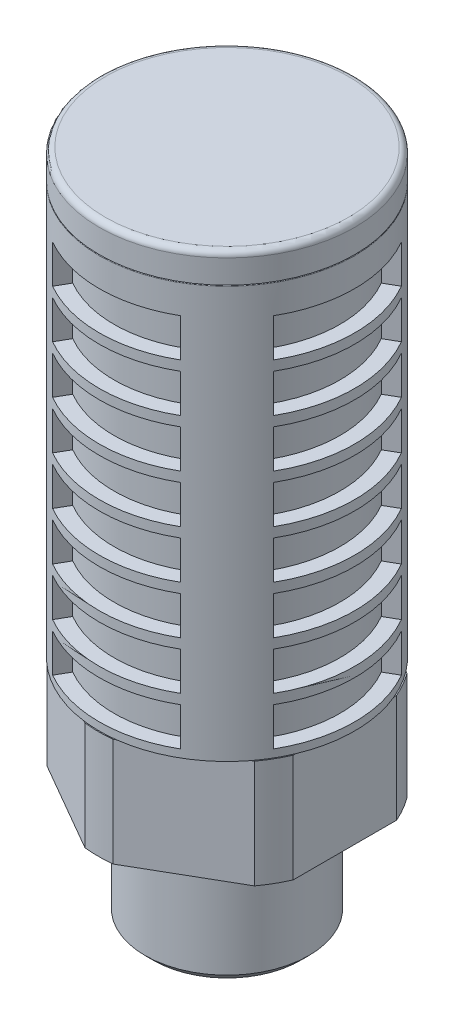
SolidWorks part; units mm, degrees
ref_plane "前视基准面" through (0, 0, 0) normal (0, 0, 1) x (1, 0, 0)
ref_plane "上视基准面" through (0, 0, 0) normal (0, 1, 0) x (1, 0, 0)
ref_plane "右视基准面" through (0, 0, 0) normal (1, 0, 0) x (0, 0, -1)
sketch "草图1" plane through (0, 0, 0) normal (0, 0, 1) x (1, 0, 0)
  line L0 (0, 68) -> (12.4, 68)
  line L1 (13, 67.4) -> (13, 65)
  line L2 (13, 65) -> (12.9, 65)
  line L3 (13, 64.9) -> (13, 23)
  line L4 (13, 23) -> (13.1064, 23)
  line L5 (13.1064, 23) -> (13.1064, 12)
  line L6 (13.1064, 12) -> (8.331, 12)
  line L7 (8.331, 12) -> (8.331, 0.856)
  line L8 (8.331, 0.856) -> (7.475, 0)
  line L9 (7.475, 0) -> (4.1655, 0)
  line L10 (4.1655, 0) -> (4.1655, 63)
  line L11 (4.1655, 63) -> (0, 65.405)
  line L12 (0, 65.405) -> (0, 68)
  line L13 (0, 0) -> (0, 68) construction
  arc A0 (12.4, 68) -> (13, 67.4) centre (12.4, 67.4) cw
  arc A1 (12.9, 65) -> (13, 64.9) centre (12.9, 64.9) cw
revolve "旋转1" add sketch "草图1" angle 360 about L13
sketch "草图2" plane through (0, 0, 0) normal (0, 0, 1) x (1, 0, 0)
  line L0 (11.5, 62) -> (11.5, 58.1)
  line L1 (11.5, 58.1) -> (13, 58.1)
  line L2 (13, 58.1) -> (13, 57.1)
  line L3 (13, 57.1) -> (11.5, 57.1)
  line L4 (11.5, 57.1) -> (11.5, 53.2)
  line L5 (11.5, 53.2) -> (13, 53.2)
  line L6 (13, 53.2) -> (13, 52.2)
  line L7 (13, 52.2) -> (11.5, 52.2)
  line L8 (11.5, 52.2) -> (11.5, 48.3)
  line L9 (11.5, 48.3) -> (13, 48.3)
  line L10 (13, 48.3) -> (13, 47.3)
  line L11 (13, 47.3) -> (11.5, 47.3)
  line L12 (11.5, 47.3) -> (11.5, 43.4)
  line L13 (11.5, 43.4) -> (13, 43.4)
  line L14 (13, 43.4) -> (13, 42.4)
  line L15 (13, 42.4) -> (11.5, 42.4)
  line L16 (11.5, 42.4) -> (11.5, 38.5)
  line L17 (11.5, 38.5) -> (13, 38.5)
  line L18 (13, 38.5) -> (13, 37.5)
  line L19 (13, 37.5) -> (11.5, 37.5)
  line L20 (11.5, 37.5) -> (11.5, 33.6)
  line L21 (11.5, 33.6) -> (13, 33.6)
  line L22 (13, 33.6) -> (13, 32.6)
  line L23 (13, 32.6) -> (11.5, 32.6)
  line L24 (11.5, 32.6) -> (11.5, 28.7)
  line L25 (11.5, 28.7) -> (13, 28.7)
  line L26 (13, 28.7) -> (13, 27.7)
  line L27 (13, 27.7) -> (11.5, 27.7)
  line L28 (11.5, 27.7) -> (11.5, 23.8)
  line L29 (11.5, 23.8) -> (26, 23.8)
  line L30 (26, 23.8) -> (26, 62)
  line L31 (26, 62) -> (11.5, 62)
  line L32 (0, 23.8) -> (0, 62) construction
revolve "切除-旋转1" cut sketch "草图2" angle 30 about L32
sketch "草图3" plane through (0, 0, 0) normal (0, 0, 1) x (1, 0, 0)
  line L0 (-26, 62) -> (-26, 23.8)
  line L1 (-26, 23.8) -> (-11.5, 23.8)
  line L2 (-11.5, 23.8) -> (-11.5, 27.7)
  line L3 (-11.5, 27.7) -> (-13, 27.7)
  line L4 (-13, 27.7) -> (-13, 28.7)
  line L5 (-13, 28.7) -> (-11.5, 28.7)
  line L6 (-11.5, 28.7) -> (-11.5, 32.6)
  line L7 (-11.5, 32.6) -> (-13, 32.6)
  line L8 (-13, 32.6) -> (-13, 33.6)
  line L9 (-13, 33.6) -> (-11.5, 33.6)
  line L10 (-11.5, 33.6) -> (-11.5, 37.5)
  line L11 (-11.5, 37.5) -> (-13, 37.5)
  line L12 (-13, 37.5) -> (-13, 38.5)
  line L13 (-13, 38.5) -> (-11.5, 38.5)
  line L14 (-11.5, 38.5) -> (-11.5, 42.4)
  line L15 (-11.5, 42.4) -> (-13, 42.4)
  line L16 (-13, 42.4) -> (-13, 43.4)
  line L17 (-13, 43.4) -> (-11.5, 43.4)
  line L18 (-11.5, 43.4) -> (-11.5, 47.3)
  line L19 (-11.5, 47.3) -> (-13, 47.3)
  line L20 (-13, 47.3) -> (-13, 48.3)
  line L21 (-13, 48.3) -> (-11.5, 48.3)
  line L22 (-11.5, 48.3) -> (-11.5, 52.2)
  line L23 (-11.5, 52.2) -> (-13, 52.2)
  line L24 (-13, 52.2) -> (-13, 53.2)
  line L25 (-13, 53.2) -> (-11.5, 53.2)
  line L26 (-11.5, 53.2) -> (-11.5, 57.1)
  line L27 (-11.5, 57.1) -> (-13, 57.1)
  line L28 (-13, 57.1) -> (-13, 58.1)
  line L29 (-13, 58.1) -> (-11.5, 58.1)
  line L30 (-11.5, 58.1) -> (-11.5, 62)
  line L31 (-11.5, 62) -> (-26, 62)
  line L32 (0, 62) -> (0, 23.8) construction
revolve "切除-旋转2" cut sketch "草图3" angle 30 about L32
sketch "草图4" plane through (0, 0, 0) normal (1, 0, 0) x (0, 0, -1)
  line L0 (11.5, 62) -> (11.5, 58.1)
  line L1 (11.5, 58.1) -> (13, 58.1)
  line L2 (13, 58.1) -> (13, 57.1)
  line L3 (13, 57.1) -> (11.5, 57.1)
  line L4 (11.5, 57.1) -> (11.5, 53.2)
  line L5 (11.5, 53.2) -> (13, 53.2)
  line L6 (13, 53.2) -> (13, 52.2)
  line L7 (13, 52.2) -> (11.5, 52.2)
  line L8 (11.5, 52.2) -> (11.5, 48.3)
  line L9 (11.5, 48.3) -> (13, 48.3)
  line L10 (13, 48.3) -> (13, 47.3)
  line L11 (13, 47.3) -> (11.5, 47.3)
  line L12 (11.5, 47.3) -> (11.5, 43.4)
  line L13 (11.5, 43.4) -> (13, 43.4)
  line L14 (13, 43.4) -> (13, 42.4)
  line L15 (13, 42.4) -> (11.5, 42.4)
  line L16 (11.5, 42.4) -> (11.5, 38.5)
  line L17 (11.5, 38.5) -> (13, 38.5)
  line L18 (13, 38.5) -> (13, 37.5)
  line L19 (13, 37.5) -> (11.5, 37.5)
  line L20 (11.5, 37.5) -> (11.5, 33.6)
  line L21 (11.5, 33.6) -> (13, 33.6)
  line L22 (13, 33.6) -> (13, 32.6)
  line L23 (13, 32.6) -> (11.5, 32.6)
  line L24 (11.5, 32.6) -> (11.5, 28.7)
  line L25 (11.5, 28.7) -> (13, 28.7)
  line L26 (13, 28.7) -> (13, 27.7)
  line L27 (13, 27.7) -> (11.5, 27.7)
  line L28 (11.5, 27.7) -> (11.5, 23.8)
  line L29 (11.5, 23.8) -> (26, 23.8)
  line L30 (26, 23.8) -> (26, 62)
  line L31 (26, 62) -> (11.5, 62)
  line L32 (0, 23.8) -> (0, 62) construction
revolve "切除-旋转3" cut sketch "草图4" angle 30 about L32
sketch "草图5" plane through (0, 0, 0) normal (1, 0, 0) x (0, 0, -1)
  line L0 (-26, 62) -> (-26, 23.8)
  line L1 (-26, 23.8) -> (-11.5, 23.8)
  line L2 (-11.5, 23.8) -> (-11.5, 27.7)
  line L3 (-11.5, 27.7) -> (-13, 27.7)
  line L4 (-13, 27.7) -> (-13, 28.7)
  line L5 (-13, 28.7) -> (-11.5, 28.7)
  line L6 (-11.5, 28.7) -> (-11.5, 32.6)
  line L7 (-11.5, 32.6) -> (-13, 32.6)
  line L8 (-13, 32.6) -> (-13, 33.6)
  line L9 (-13, 33.6) -> (-11.5, 33.6)
  line L10 (-11.5, 33.6) -> (-11.5, 37.5)
  line L11 (-11.5, 37.5) -> (-13, 37.5)
  line L12 (-13, 37.5) -> (-13, 38.5)
  line L13 (-13, 38.5) -> (-11.5, 38.5)
  line L14 (-11.5, 38.5) -> (-11.5, 42.4)
  line L15 (-11.5, 42.4) -> (-13, 42.4)
  line L16 (-13, 42.4) -> (-13, 43.4)
  line L17 (-13, 43.4) -> (-11.5, 43.4)
  line L18 (-11.5, 43.4) -> (-11.5, 47.3)
  line L19 (-11.5, 47.3) -> (-13, 47.3)
  line L20 (-13, 47.3) -> (-13, 48.3)
  line L21 (-13, 48.3) -> (-11.5, 48.3)
  line L22 (-11.5, 48.3) -> (-11.5, 52.2)
  line L23 (-11.5, 52.2) -> (-13, 52.2)
  line L24 (-13, 52.2) -> (-13, 53.2)
  line L25 (-13, 53.2) -> (-11.5, 53.2)
  line L26 (-11.5, 53.2) -> (-11.5, 57.1)
  line L27 (-11.5, 57.1) -> (-13, 57.1)
  line L28 (-13, 57.1) -> (-13, 58.1)
  line L29 (-13, 58.1) -> (-11.5, 58.1)
  line L30 (-11.5, 58.1) -> (-11.5, 62)
  line L31 (-11.5, 62) -> (-26, 62)
  line L32 (0, 62) -> (0, 23.8) construction
revolve "切除-旋转4" cut sketch "草图5" angle 30 about L32
ref_plane "基准面1" through (0, 12, 0) normal (0, 1, 0) x (1, 0, 0)
sketch "草图6" plane through (0, 12, 0) normal (0, 1, 0) x (1, 0, 0)
  line L0 (-12, -6.9282) -> (0, -13.8564)
  line L1 (0, -13.8564) -> (12, -6.9282)
  line L2 (12, -6.9282) -> (12, 6.9282)
  line L3 (12, 6.9282) -> (0, 13.8564)
  line L4 (0, 13.8564) -> (-12, 6.9282)
  line L5 (-12, 6.9282) -> (-12, -6.9282)
  circle A0 centre (0, 0) radius 24
extrude "切除-拉伸1" cut sketch "草图6" along normal blind 11
